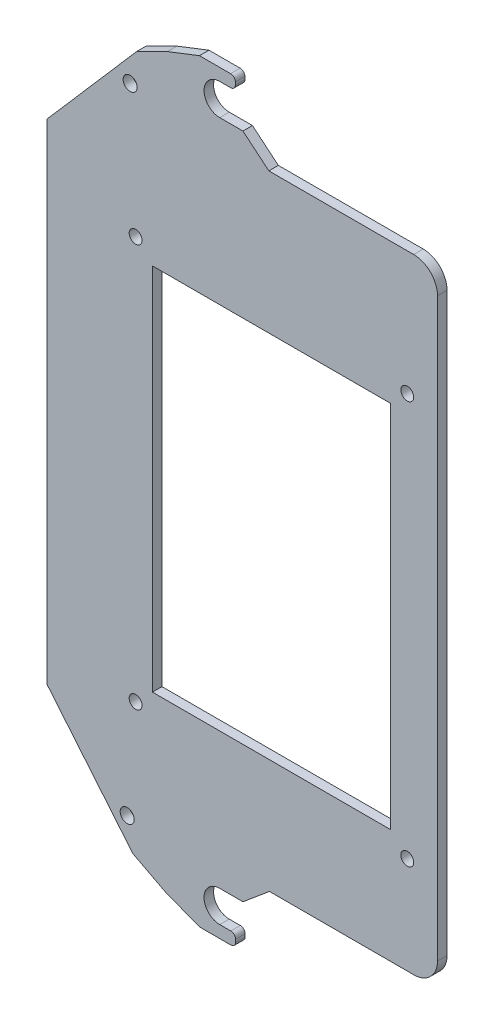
SolidWorks part; units mm, degrees
ref_plane "Front Plane" through (0, 0, 0) normal (0, 0, 1) x (1, 0, 0)
ref_plane "Top Plane" through (0, 0, 0) normal (0, 1, 0) x (1, 0, 0)
ref_plane "Right Plane" through (0, 0, 0) normal (1, 0, 0) x (0, 0, -1)
sketch "Sketch1" plane through (0, 0, 0) normal (0, 0, 1) x (1, 0, 0)
  line L0 (10871.8356, 3501.3224) -> (10871.8356, 3497.9759) construction
  line L1 (10875.1821, 3497.9759) -> (10875.1821, 3352.1098) construction
  line L2 (10876.7976, 3497.9759) -> (10882.324, 3493.3734)
  line L3 (10882.324, 3493.3734) -> (10939.9701, 3493.3734)
  line L4 (10854.1005, 3501.331) -> (10854.115, 3501.3428)
  line L5 (10871.8356, 3497.9759) -> (10876.7976, 3497.9759)
  line L6 (10871.8356, 3501.3224) -> (10871.8356, 3352.1098) construction
  line L7 (10876.7976, 3497.9759) -> (10876.7976, 3355.4604) construction
  line L8 (10834.953, 3374.7577) -> (10939.9701, 3374.7577) construction
  line L9 (10871.8356, 3355.4563) -> (10876.7976, 3355.4604)
  line L10 (10882.324, 3493.3734) -> (10882.456, 3360.1918) construction
  line L11 (10876.7976, 3355.4604) -> (10882.456, 3360.1918)
  line L12 (10882.456, 3360.1918) -> (10939.9701, 3360.1918)
  line L13 (10834.953, 3479.2648) -> (10939.9701, 3479.2648) construction
  line L14 (10939.9701, 3360.1918) -> (10939.9701, 3493.3734)
  line L15 (10871.8356, 3504.6689) -> (10875.1821, 3504.6689)
  line L16 (10875.0459, 3507.2675) -> (10867.511, 3507.2675)
  line L17 (10854.1005, 3501.331) -> (10834.953, 3479.2648)
  line L19 (10834.953, 3479.2648) -> (10834.953, 3374.7577)
  line L21 (10834.953, 3374.7577) -> (10853.2782, 3352.6193)
  line L23 (10871.8356, 3348.7633) -> (10875.2399, 3348.7633)
  line L24 (10875.1821, 3504.6689) -> (10875.1821, 3507.2675)
  line L25 (10875.1821, 3507.2675) -> (10875.0459, 3507.2675)
  line L27 (10875.2399, 3348.7633) -> (10875.2399, 3346.1649)
  line L28 (10853.2782, 3352.6193) -> (10854.1005, 3501.331) construction
  line L29 (10867.511, 3507.2675) -> (10867.511, 3346.1649) construction
  line L30 (10875.2399, 3346.1649) -> (10867.511, 3346.1649)
  line L33 (10867.511, 3346.1649) -> (10860.2223, 3348.994)
  line L34 (10860.2223, 3348.994) -> (10853.2782, 3352.6193)
  line L38 (10854.115, 3501.3428) -> (10860.6675, 3504.6038)
  line L39 (10860.6675, 3504.6038) -> (10867.511, 3507.2675)
  arc A0 (10871.8356, 3355.4563) -> (10871.8356, 3348.7633) centre (10871.8356, 3352.1098) ccw
  arc A1 (10871.8356, 3504.6689) -> (10871.8356, 3497.9759) centre (10871.8356, 3501.3224) ccw
  circle A3 centre (10852.7114, 3494.7484) radius 1.5
  circle A4 centre (10852.082, 3359.0402) radius 1.5
  point P4 (0, 0)
extrude "Boss-Extrude1" add sketch "Sketch1" along normal blind 2.032
sketch "Sketch2" plane through (0, 0, 0) normal (0, 0, -1) x (-1, 0, 0)
  line L0 (-10939.9701, 3426.7826) -> (-10834.953, 3427.0112) construction
  line L3 (-10939.9701, 3360.1918) -> (-10939.9701, 3493.3734) construction
  line L4 (-10834.953, 3479.2648) -> (-10834.953, 3374.7577) construction
  line L5 (-10834.953, 3458.1911) -> (-10853.8853, 3458.1911) construction
  line L6 (-10853.8853, 3426.97) -> (-10853.8853, 3466.9703) construction
  line L7 (-10853.8853, 3466.9703) -> (-10911.8853, 3466.9703) construction
  line L8 (-10911.8853, 3466.9703) -> (-10911.8853, 3380.9703) construction
  line L9 (-10911.8853, 3380.9703) -> (-10853.8853, 3380.9703) construction
  line L10 (-10913.2603, 3466.9703) -> (-10918.3403, 3466.9703) construction
  line L11 (-10911.8853, 3466.9703) -> (-10908.2931, 3463.3782) construction
  line L12 (-10918.3403, 3495.7535) -> (-10942.5525, 3495.7535)
  line L13 (-10918.3403, 3495.7535) -> (-10918.3403, 3355.6674)
  line L14 (-10918.3403, 3355.6674) -> (-10942.5525, 3355.6674)
  line L15 (-10942.5525, 3495.7535) -> (-10942.5525, 3355.6674)
  line L16 (-10853.8853, 3466.9703) -> (-10857.4774, 3463.3782) construction
  line L17 (-10911.8853, 3380.9703) -> (-10908.2931, 3384.5624) construction
  line L18 (-10853.8853, 3380.9703) -> (-10857.4774, 3384.5624) construction
  line L20 (-10908.2931, 3463.3782) -> (-10857.4774, 3463.3782)
  line L21 (-10908.2931, 3463.3782) -> (-10908.2931, 3384.5624)
  line L22 (-10908.2931, 3384.5624) -> (-10857.4774, 3384.5624)
  line L23 (-10857.4774, 3463.3782) -> (-10857.4774, 3384.5624)
  circle A0 centre (-10853.8853, 3466.9703) radius 1.375
  circle A1 centre (-10911.8853, 3466.9703) radius 1.375
  circle A2 centre (-10911.8853, 3380.9703) radius 1.375
  circle A3 centre (-10853.8853, 3380.9703) radius 1.375
extrude "Cut-Extrude1" cut sketch "Sketch2" against normal blind 2.032
fillet "Fillet1" radius 5.08 1 edges at (10918.3403, 3493.3734, 1.016)
fillet "Fillet2" radius 5.08 1 edges at (10918.3403, 3360.1918, 1.016)
fillet "Fillet3" radius 1.016 1 edges at (10875.2399, 3346.1649, 1.016)
fillet "Fillet4" radius 1.016 1 edges at (10875.2399, 3348.7633, 1.016)
fillet "Fillet5" radius 1.016 1 edges at (10875.1821, 3504.6689, 1.016)
fillet "Fillet6" radius 1.016 1 edges at (10875.1821, 3507.2675, 1.016)
